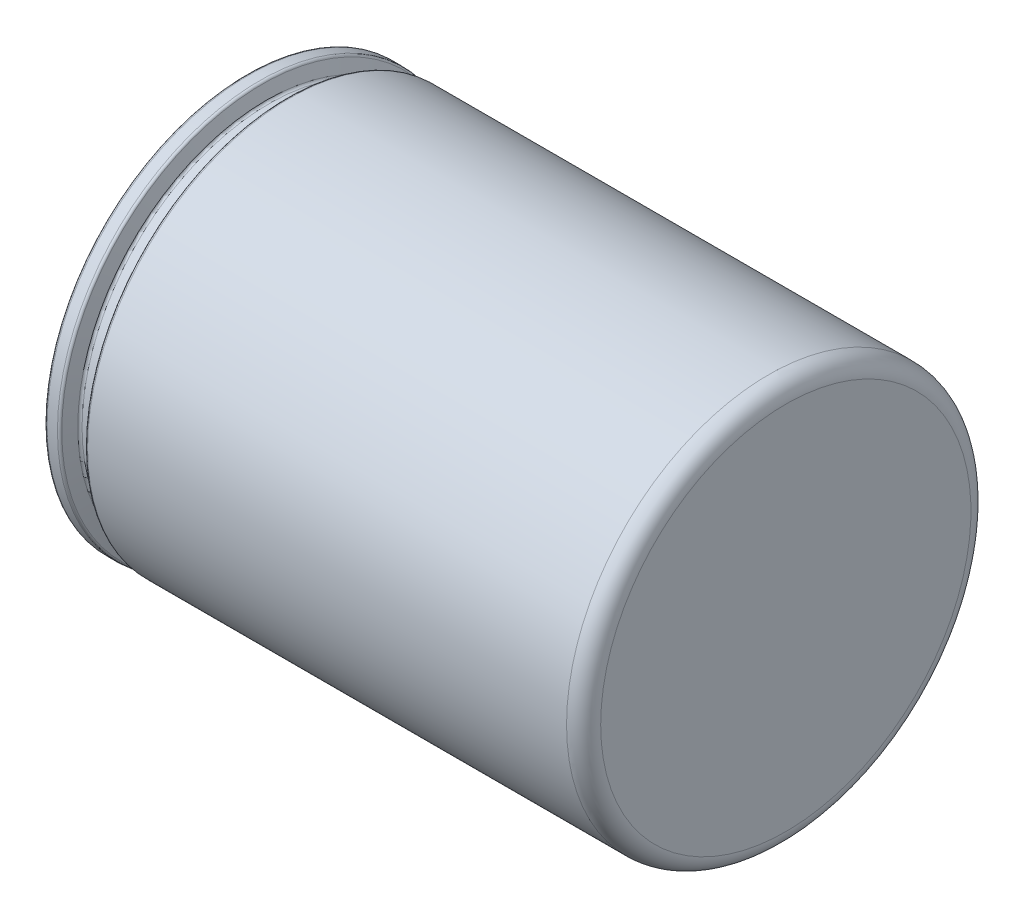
SolidWorks part; units mm, degrees
ref_plane "Front" through (0, 0, 0) normal (0, 0, 1) x (1, 0, 0)
ref_plane "Top" through (0, 0, 0) normal (0, 1, 0) x (1, 0, 0)
ref_plane "Right" through (0, 0, 0) normal (1, 0, 0) x (0, 0, -1)
sketch "Sketch1" plane through (0, 0, 0) normal (0, 0, 1) x (1, 0, 0)
  line L0 (0, 0) -> (152.4, 0) construction
  line L1 (152.4, 0) -> (152.4, 52.324)
  line L2 (147.574, 57.15) -> (12.192, 57.15)
  line L3 (11.43, 56.388) -> (11.43, 53.594)
  line L4 (0, 49.149) -> (0, 56.388)
  line L5 (0.762, 57.15) -> (3.6828, 57.15)
  line L6 (4.3989, 56.6486) -> (5.6055, 53.3334)
  line L7 (10.668, 52.832) -> (6.3216, 52.832)
  line L8 (152.4, 0) -> (128.524, 0)
  line L9 (1.524, 47.625) -> (125.349, 47.625)
  line L11 (128.524, 44.45) -> (128.524, 0)
  arc A0 (0.762, 57.15) -> (0, 56.388) centre (0.762, 56.388) ccw
  arc A1 (4.3989, 56.6486) -> (3.6828, 57.15) centre (3.6828, 56.388) ccw
  arc A2 (6.3216, 52.832) -> (5.6055, 53.3334) centre (6.3216, 53.594) cw
  arc A3 (11.43, 53.594) -> (10.668, 52.832) centre (10.668, 53.594) cw
  arc A4 (12.192, 57.15) -> (11.43, 56.388) centre (12.192, 56.388) ccw
  arc A5 (152.4, 52.324) -> (147.574, 57.15) centre (147.574, 52.324) ccw
  arc A6 (128.524, 44.45) -> (125.349, 47.625) centre (125.349, 44.45) ccw
  arc A7 (0, 49.149) -> (1.524, 47.625) centre (1.524, 49.149) ccw
  dimension "D1" = 0.762
  dimension "D2" = 4.826
  dimension "D5" = 3.175
  dimension "D6" = 1.524
  dimension "D3" = 47.625
  dimension "D4" = 23.876
revolve "Revolve1" add sketch "Sketch1" angle 360 about L0
